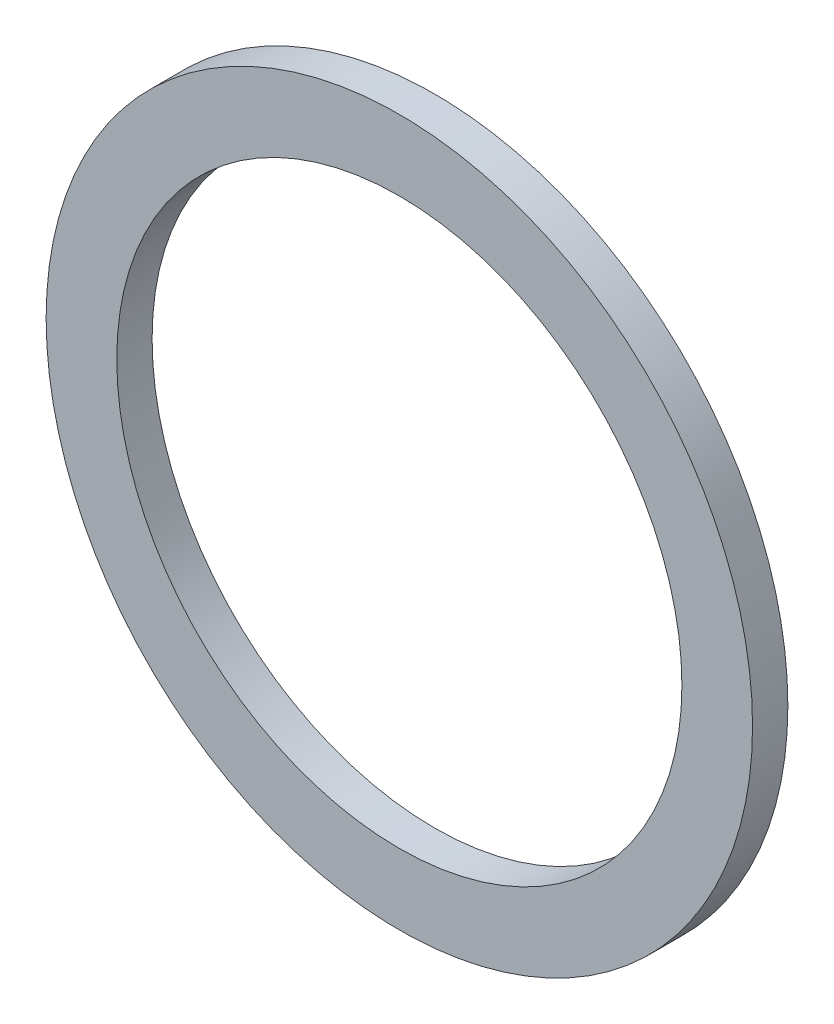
SolidWorks part; units mm, degrees
ref_plane "Face" through (0, 0, 0) normal (0, 0, 1) x (1, 0, 0)
ref_plane "Dessus" through (0, 0, 0) normal (0, 1, 0) x (1, 0, 0)
ref_plane "Droite" through (0, 0, 0) normal (1, 0, 0) x (0, 0, -1)
sketch "Esquisse1" plane through (0, 0, 0) normal (0, 0, 1) x (1, 0, 0)
  circle A0 centre (0, 0) radius 50
  circle A1 centre (0, 0) radius 40
  dimension "D1" = 100
  dimension "D2" = 10
extrude "Extrusion1" add sketch "Esquisse1" along normal blind 5
